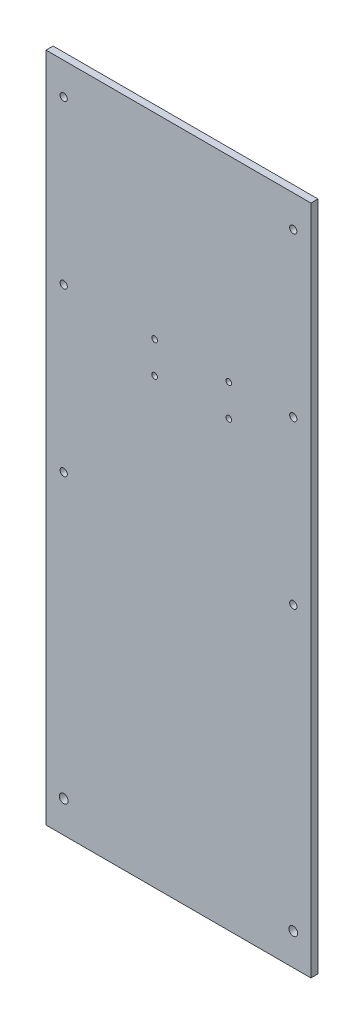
SolidWorks part; units mm, degrees
ref_plane "前视基准面" through (0, 0, 0) normal (0, 0, 1) x (1, 0, 0)
ref_plane "上视基准面" through (0, 0, 0) normal (0, 1, 0) x (1, 0, 0)
ref_plane "右视基准面" through (0, 0, 0) normal (1, 0, 0) x (0, 0, -1)
sketch "草图1" plane through (0, 0, 0) normal (0, 0, 1) x (1, 0, 0)
  line L1 (-75, 190) -> (75, 190)
  line L2 (-75, 190) -> (-75, -190)
  line L3 (-75, -190) -> (75, -190)
  line L4 (75, 190) -> (75, -190)
  line L5 (-75, 190) -> (75, -190) construction
  line L6 (-75, -190) -> (75, 190) construction
  point P0 (0, 0)
  dimension "D1" = 380
  dimension "D2" = 150
extrude "凸台-拉伸1" add sketch "草图1" along normal blind 4
sketch "草图2" plane through (0, 0, 0) normal (0, 0, -1) x (-1, 0, 0)
  circle A0 centre (-28.5, 61) radius 1.6
  circle A1 centre (13.5, 61) radius 1.6
  circle A2 centre (13.5, 79) radius 1.6
  circle A3 centre (-28.5, 79) radius 1.6
  dimension "D2" = 3.2
  dimension "D3" = 3.2
  dimension "D4" = 3.2
  dimension "D5" = 3.2
extrude "切除-拉伸2" cut sketch "草图2" against normal blind 10
sketch "草图3" plane through (0, 0, 0) normal (0, 0, -1) x (-1, 0, 0)
  line L0 (-75, 190) -> (75, 190) construction
  line L1 (-75, -190) -> (-75, 190) construction
  line L2 (75, -190) -> (-75, -190) construction
  line L3 (0, 256.2685) -> (0, -243.7315) construction
  circle A0 centre (-65, 172) radius 2.05
  circle A1 centre (-65, 80) radius 2.05
  circle A2 centre (-65, -172) radius 2.5
  circle A3 centre (65, 80) radius 2.05
  circle A4 centre (-65, -12) radius 2.05
  circle A5 centre (65, -172) radius 2.5
  circle A6 centre (65, -12) radius 2.05
  circle A7 centre (65, 172) radius 2.05
  dimension "D1" = 5
  dimension "D2" = 3
  dimension "D3" = 4.1
  dimension "D4" = 18
  dimension "D5" = 10
  dimension "D6" = 10
  dimension "D7" = 18
extrude "切除-拉伸3" cut sketch "草图3" against normal through all
